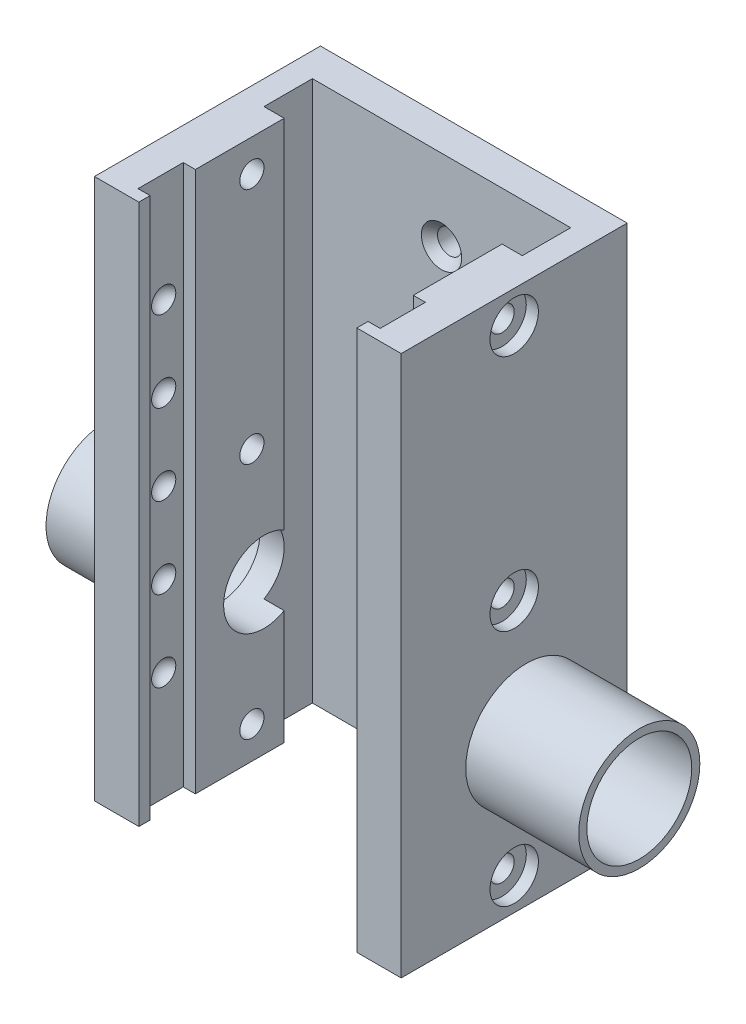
SolidWorks part; units mm, degrees
ref_plane "Plan de face" through (0, 0, 0) normal (0, 0, 1) x (1, 0, 0)
ref_plane "Plan de dessus" through (0, 0, 0) normal (0, 1, 0) x (1, 0, 0)
ref_plane "Plan de droite" through (0, 0, 0) normal (1, 0, 0) x (0, 0, -1)
sketch "Esquisse1" plane through (0, 0, 0) normal (0, 1, 0) x (1, 0, 0)
  line L0 (35, 24) -> (35, 18)
  line L1 (38, 0) -> (32.5, 0)
  line L2 (0, 0) -> (0, 28)
  line L3 (0, 28) -> (38, 28)
  line L4 (38, 0) -> (38, 28)
  line L5 (5.5, 1.3949) -> (5.5, 0)
  line L6 (4, 1.3949) -> (5.5, 1.3949)
  line L7 (32.5, 18) -> (32.5, 7)
  line L8 (35, 18) -> (32.5, 18)
  line L9 (4, 7) -> (4, 1.3949)
  line L10 (34, 7) -> (32.5, 7)
  line L11 (4, 7) -> (5.5, 7)
  line L12 (19, 28) -> (19, 0) construction
  line L13 (3, 18) -> (5.5, 18)
  line L14 (5.5, 18) -> (5.5, 7)
  line L15 (34, 7) -> (34, 1.3949)
  line L16 (3, 24) -> (3, 18)
  line L17 (35, 24) -> (3, 24)
  line L18 (5.5, 0) -> (0, 0)
  line L19 (34, 1.3949) -> (32.5, 1.3949)
  line L20 (32.5, 1.3949) -> (32.5, 0)
  dimension "D1" = 38
  dimension "D2" = 28
  dimension "D4" = 4
  dimension "D6" = 6
  dimension "D7" = 3
  dimension "D8" = 5.5
  dimension "D3" = 11
extrude "Extrusion1" add sketch "Esquisse1" along normal blind 67
sketch "Esquisse2" plane through (38, 0, 0) normal (1, 0, 0) x (0, 0, -1)
  line L0 (14, 67) -> (14, 0) construction
  line L1 (0, 67) -> (28, 67) construction
  line L2 (0, 0) -> (28, 0) construction
  circle A0 centre (14, 33.5) radius 3
  circle A1 centre (14, 63) radius 3
  circle A2 centre (14, 4) radius 3
  dimension "D1" = 4
  dimension "D2" = 4
extrude "Enlèv. mat.-Extru.1" cut sketch "Esquisse2" against normal blind 1.5
ref_plane "Plan1" through (19, 0, 0) normal (1, 0, 0) x (0, 0, -1)
mirror "Symétrie1" about plane through (19, 0, 0) normal (1, 0, 0) of "Enlèv. mat.-Extru.1"
sketch "Esquisse3" plane through (1.5, 0, 0) normal (-1, 0, 0) x (0, 0, 1)
  circle A0 centre (-14, 4) radius 1.5
  circle A1 centre (-14, 33.5) radius 1.5
  circle A2 centre (-14, 63) radius 1.5
extrude "Enlèv. mat.-Extru.2" cut sketch "Esquisse3" against normal through all
sketch "Esquisse4" plane through (38, 0, 0) normal (1, 0, 0) x (0, 0, -1)
  line L0 (-7.0827, 18.5) -> (35.0827, 18.5) construction
  line L1 (15.5, 37.4902) -> (15.5, 9.4829) construction
  line L3 (0, 67) -> (0, 0) construction
  line L4 (0, 0) -> (28, 0) construction
  circle A0 centre (15.5, 18.5) radius 5
  dimension "D1" = 15.5
  dimension "D2" = 18.5
extrude "Enlèv. mat.-Extru.3" cut sketch "Esquisse4" against normal through all
sketch "Esquisse5" plane through (38, 0, 0) normal (1, 0, 0) x (0, 0, -1)
  circle A0 centre (15.5, 18.5) radius 7.5
  circle A1 centre (15.5, 18.5) radius 6.5
extrude "Extrusion2" add sketch "Esquisse5" along normal blind 14
mirror "Symétrie2" about plane through (19, 0, 0) normal (1, 0, 0) of "Extrusion2"
sketch "Esquisse6" plane through (4, 0, 0) normal (1, 0, 0) x (0, 0, -1)
  line L0 (4.1974, 67) -> (4.9498, 0) construction
  line L1 (1.3949, 67) -> (7, 67) construction
  line L2 (1.3949, 0) -> (7, 0) construction
  circle A2 centre (4.5736, 13.5) radius 1.5
  circle A5 centre (4.5736, 23.5) radius 1.5
  circle A6 centre (4.5736, 53.5) radius 1.5
  circle A7 centre (4.5736, 43.5) radius 1.5
  circle A8 centre (4.5736, 33.5) radius 1.5
  circle A9 centre (4.5736, 33.5) radius 1.5
  circle A10 centre (4.5736, 23.5) radius 1.5
  circle A11 centre (4.5736, 43.5) radius 1.5
  circle A12 centre (4.5736, 33.5) radius 1.5
extrude "Enlèv. mat.-Extru.4" cut sketch "Esquisse6" against normal blind 1.5
fillet "Congé1" radius 1.5 5 edges at (2.5, 13.5, -6.0736) (2.5, 23.5, -6.0736) (2.5, 53.5, -6.0736) (2.5, 43.5, -6.0736) (2.5, 33.5, -6.0736)
mirror "Symétrie3" about plane through (19, 0, 0) normal (1, 0, 0) of "Congé1", "Enlèv. mat.-Extru.4"
sketch "Esquisse7" plane through (0, 0, -24) normal (0, 0, 1) x (1, 0, 0)
  line L0 (19, 67) -> (19, 0) construction
  line L1 (3, 67) -> (35, 67) construction
  line L2 (3, 0) -> (35, 0) construction
  circle A0 centre (19, 57) radius 1.5
  circle A1 centre (19, 10) radius 1.5
  circle A2 centre (19, 33.5) radius 1.5
  dimension "D2" = 10
  dimension "D3" = 3
  dimension "D1" = 10
extrude "Enlèv. mat.-Extru.5" cut sketch "Esquisse7" against normal through all
chamfer "Chanfrein1" distance 1 angle 45 3 edges at (20.5, 57, -24) (20.5, 10, -24) (20.5, 33.5, -24)
